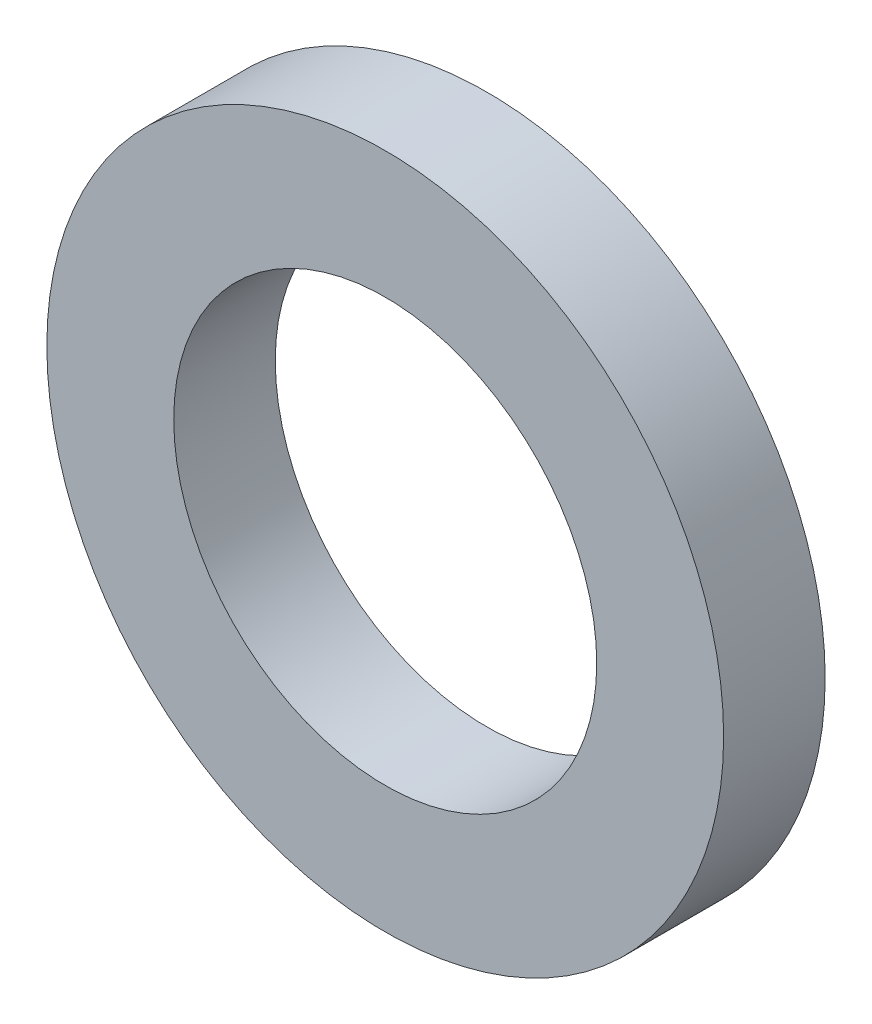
SolidWorks part; units mm, degrees
ref_plane "Plan de face" through (0, 0, 0) normal (0, 0, 1) x (1, 0, 0)
ref_plane "Plan de dessus" through (0, 0, 0) normal (0, 1, 0) x (1, 0, 0)
ref_plane "Plan de droite" through (0, 0, 0) normal (1, 0, 0) x (0, 0, -1)
sketch "Esquisse1" plane through (0, 0, 0) normal (0, 0, 1) x (1, 0, 0)
  circle A0 centre (0, 0) radius 3.75
  circle A1 centre (0, 0) radius 6
  dimension "D1" = 7.5
  dimension "D2" = 12
extrude "Boss.-Extru.1" add sketch "Esquisse1" along normal blind 1.8
